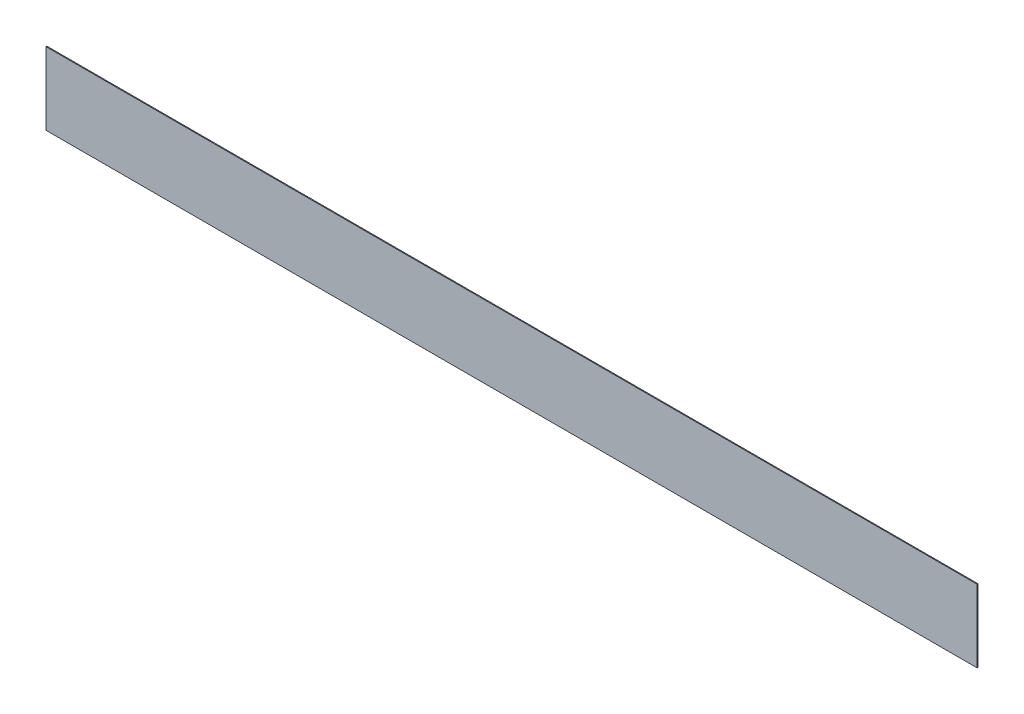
SolidWorks part; units mm, degrees
ref_plane "Plan de face" through (0, 0, 0) normal (0, 0, 1) x (1, 0, 0)
ref_plane "Plan de dessus" through (0, 0, 0) normal (0, 1, 0) x (1, 0, 0)
ref_plane "Plan de droite" through (0, 0, 0) normal (1, 0, 0) x (0, 0, -1)
sketch "Esquisse1" plane through (0, 0, 0) normal (0, 0, 1) x (1, 0, 0)
  line L1 (-118.1311, 38.8524) -> (2001.8689, 38.8524)
  line L2 (-118.1311, 38.8524) -> (-118.1311, -126.1476)
  line L3 (-118.1311, -126.1476) -> (2001.8689, -126.1476)
  line L4 (2001.8689, 38.8524) -> (2001.8689, -126.1476)
  dimension "D1" = 2120
  dimension "D2" = 165
extrude "Boss.-Extru.1" add sketch "Esquisse1" along normal blind 2
